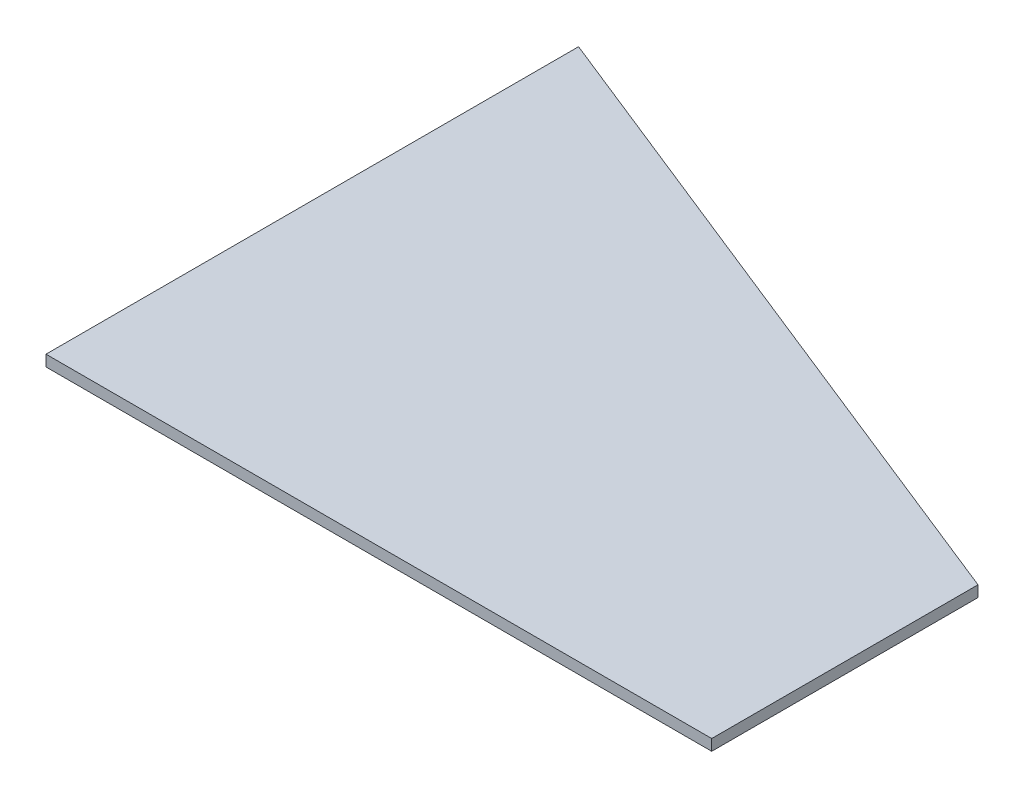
SolidWorks part; units mm, degrees
ref_plane "Front Plane" through (0, 0, 0) normal (1, 0, 0) x (0, 1, 0)
ref_plane "Top Plane" through (0, 0, 0) normal (0, 0, 1) x (0, 1, 0)
ref_plane "Right Plane" through (0, 0, 0) normal (0, 1, 0) x (-1, 0, 0)
sketch "Sketch1" plane through (0, 0, 0) normal (1, 0, 0) x (0, 1, 0)
  line L1 (152.4, -152.4) -> (158.75, -152.4)
  line L2 (152.4, -152.4) -> (152.4, 152.4)
  line L3 (152.4, 152.4) -> (158.75, 152.4)
  line L4 (158.75, -152.4) -> (158.75, 152.4)
ref_plane "Plane1" through (304.8, 0, 0) normal (1, 0, 0) x (0, 1, 0)
sketch "Sketch2" plane through (304.8, 0, 0) normal (1, 0, 0) x (0, 1, 0)
  line L1 (76.2, -76.2) -> (82.55, -76.2)
  line L2 (76.2, -76.2) -> (76.2, 76.2)
  line L3 (76.2, 76.2) -> (82.55, 76.2)
  line L4 (82.55, -76.2) -> (82.55, 76.2)
loft "Tapered_plywood_panel" add profiles "Sketch1", "Sketch2"
